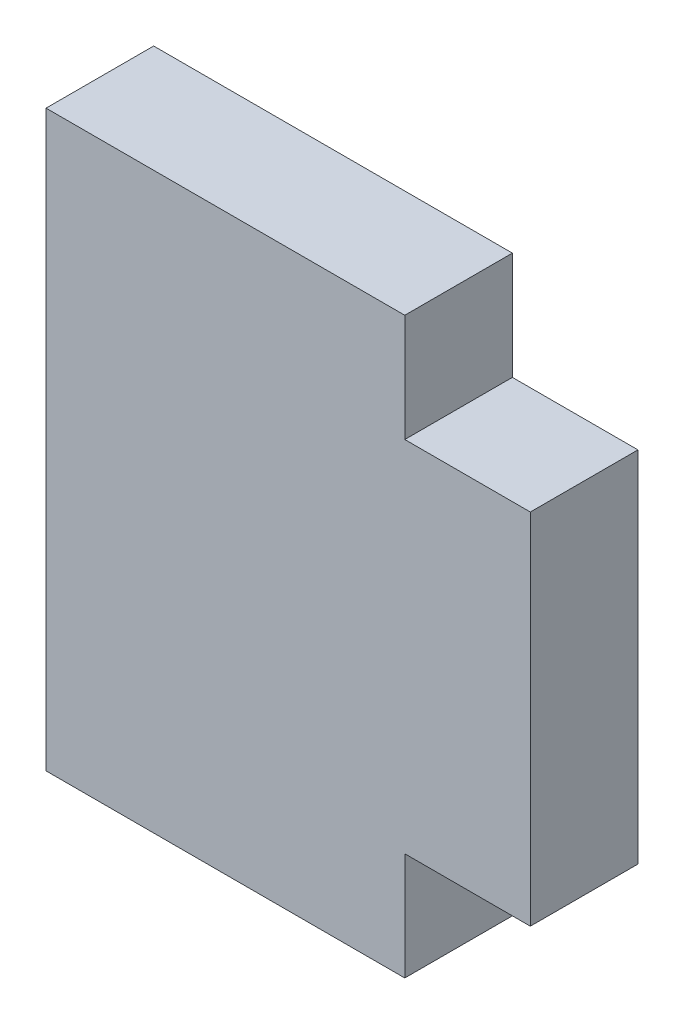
SolidWorks part; units mm, degrees
ref_plane "Front Plane" through (0, 0, 0) normal (0, 0, 1) x (1, 0, 0)
ref_plane "Top Plane" through (0, 0, 0) normal (0, 1, 0) x (1, 0, 0)
ref_plane "Right Plane" through (0, 0, 0) normal (1, 0, 0) x (0, 0, -1)
sketch "Sketch1" plane through (0, 0, 0) normal (0, 0, 1) x (1, 0, 0)
  line L0 (-305.0287, 211.3422) -> (-305.0287, 217.3422)
  line L1 (-305.0287, 217.3422) -> (-298.0287, 217.3422)
  line L2 (-298.0287, 217.3422) -> (-298.0287, 237.3422)
  line L3 (-298.0287, 237.3422) -> (-305.0287, 237.3422)
  line L4 (-305.0287, 237.3422) -> (-305.0287, 243.3422)
  line L5 (-305.0287, 243.3422) -> (-325.0287, 243.3422)
  line L6 (-325.0287, 243.3422) -> (-325.0287, 237.3422)
  line L7 (-325.0287, 237.3422) -> (-325.0287, 211.3422)
  line L8 (-325.0287, 211.3422) -> (-305.0287, 211.3422)
extrude "Boss-Extrude1" add sketch "Sketch1" along normal blind 6
